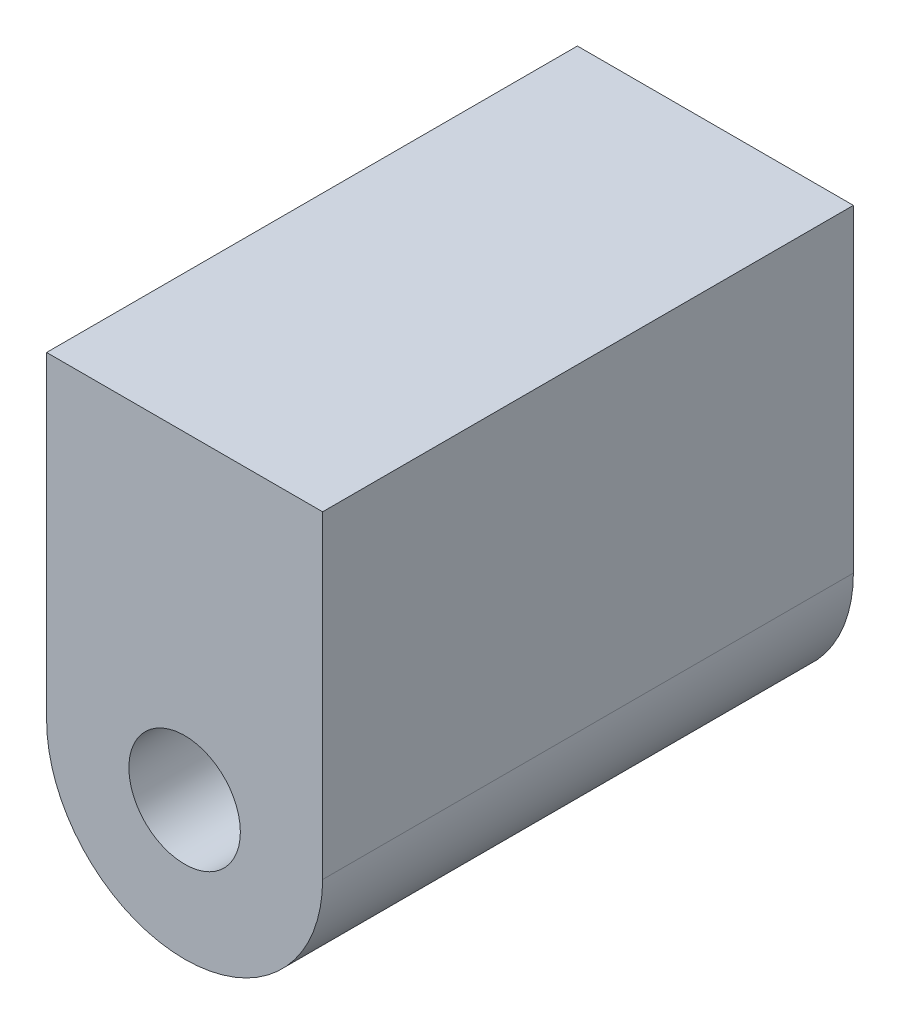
SolidWorks part; units mm, degrees
ref_plane "Plan de face" through (0, 0, 0) normal (0, 0, 1) x (1, 0, 0)
ref_plane "Plan de dessus" through (0, 0, 0) normal (0, 1, 0) x (1, 0, 0)
ref_plane "Plan de droite" through (0, 0, 0) normal (1, 0, 0) x (0, 0, -1)
sketch "Esquisse1" plane through (0, 0, 0) normal (0, 0, 1) x (1, 0, 0)
  line L2 (-13, 0) -> (-13, 30)
  line L3 (-13, 30) -> (13, 30)
  line L4 (13, 0) -> (13, 30)
  arc A0 (-13, 0) -> (13, 0) centre (0, 0) ccw
  circle A1 centre (0, 0) radius 5.25
  dimension "D1" = 13
  dimension "D3" = 10.5
  dimension "D2" = 30
extrude "Boss.-Extru.1" add sketch "Esquisse1" along normal blind 50
